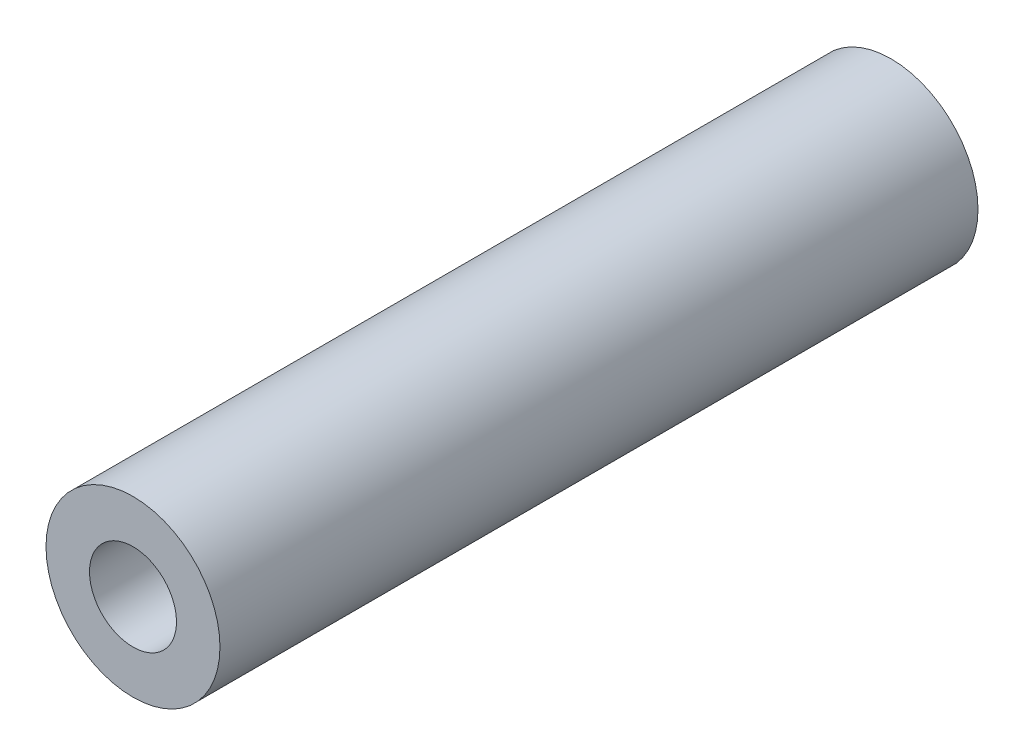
SolidWorks part; units mm, degrees
ref_plane "Plan de face" through (0, 0, 0) normal (0, 0, 1) x (1, 0, 0)
ref_plane "Plan de dessus" through (0, 0, 0) normal (0, 1, 0) x (1, 0, 0)
ref_plane "Plan de droite" through (0, 0, 0) normal (1, 0, 0) x (0, 0, -1)
sketch "Esquisse1" plane through (0, 0, 0) normal (0, 0, 1) x (1, 0, 0)
  circle A0 centre (0, 0) radius 3.5
  circle A1 centre (0, 0) radius 1.75
  dimension "D1" = 7
  dimension "D2" = 3.5
extrude "Extrusion1" add sketch "Esquisse1" along normal mid plane 30.5
